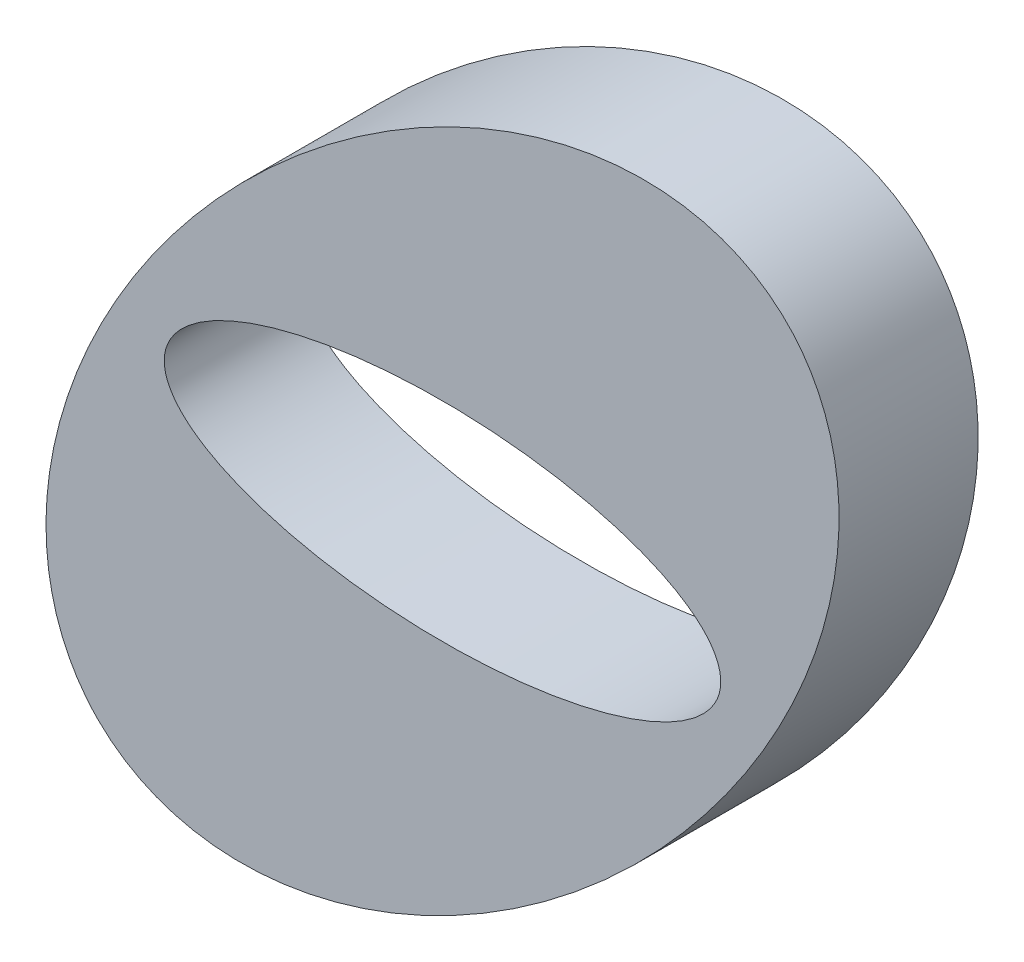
SolidWorks part; units mm, degrees
ref_plane "Front" through (0, 0, 0) normal (0, 0, 1) x (1, 0, 0)
ref_plane "Top" through (0, 0, 0) normal (0, 1, 0) x (1, 0, 0)
ref_plane "Right" through (0, 0, 0) normal (1, 0, 0) x (0, 0, -1)
sketch "Sketch1" plane through (0, 0, 0) normal (0, 0, 1) x (1, 0, 0)
  line L0 (0, 0) -> (40, 0) construction
  line L1 (0, 0) -> (-28.2843, 28.2843) construction
  ellipse E0 centre (0, 0) end of major axis (40, 0) minor radius 15
  ellipse E1 centre (0, 0) end of major axis (-49.4975, -49.4975) minor radius 40
  dimension "D1" = 40
  dimension "D2" = 15
  dimension "D3" = 135
  dimension "D4" = 70
  dimension "D5" = 40
extrude "Extrude1" add sketch "Sketch1" along normal blind 20
